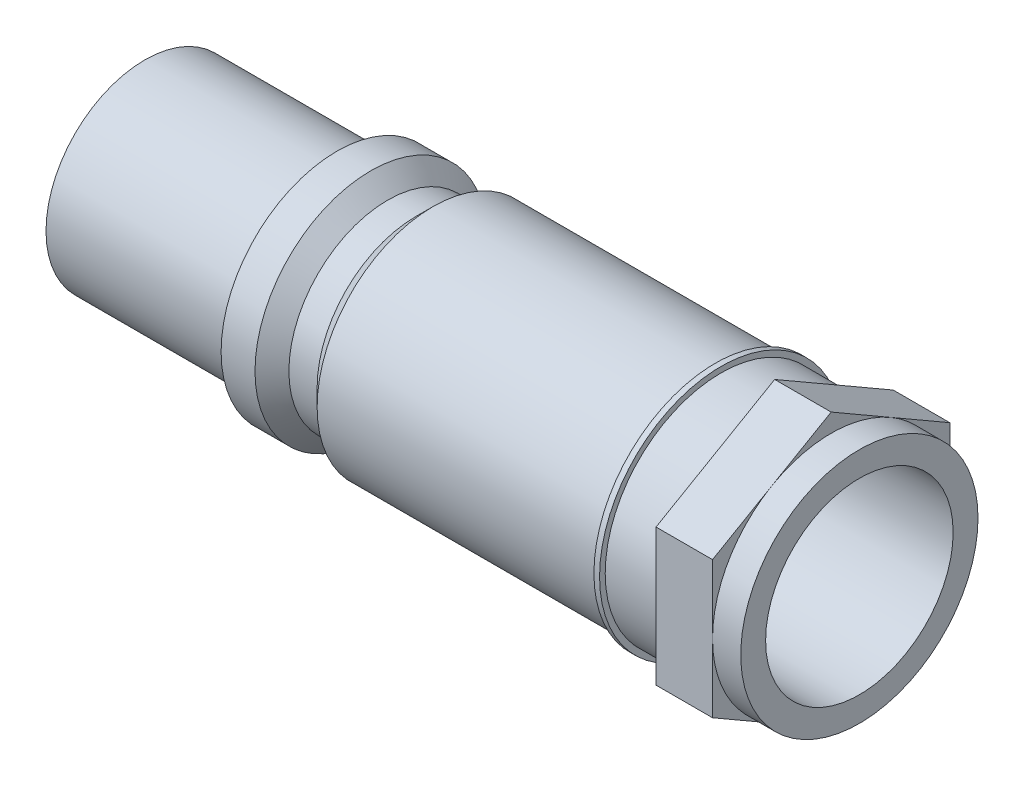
SolidWorks part; units mm, degrees
ref_plane "Alzado" through (0, 0, 0) normal (0, 0, 1) x (1, 0, 0)
ref_plane "Planta" through (0, 0, 0) normal (0, 1, 0) x (1, 0, 0)
ref_plane "Vista lateral" through (0, 0, 0) normal (1, 0, 0) x (0, 0, -1)
sketch "Croquis1" plane through (0, 0, 0) normal (0, 0, 1) x (1, 0, 0)
  line L0 (0, 0) -> (111.5, 0) construction
  line L1 (0, 0) -> (0, 17.5)
  line L2 (0, 17.5) -> (34, 17.5)
  line L3 (34, 17.5) -> (34, 20.5)
  line L4 (34, 20.5) -> (40, 20.5)
  line L5 (40, 20.5) -> (43, 17.5)
  line L6 (43, 17.5) -> (48, 17.5)
  line L7 (48, 17.5) -> (51, 20.5)
  line L11 (111.5, 20.5) -> (111.5, 0)
  line L12 (0, 0) -> (111.5, 0)
  line L13 (51, 20.5) -> (101, 20.5)
  line L14 (101, 20.5) -> (101, 21.5)
  line L15 (101, 21.5) -> (102, 21.5)
  line L16 (102, 21.5) -> (102, 20.5)
  line L17 (102, 20.5) -> (111.5, 20.5)
  dimension "D1" = 35
  dimension "D2" = 111.5
  dimension "D3" = 50
  dimension "D4" = 1
  dimension "D5" = 34
  dimension "D6" = 6
  dimension "D7" = 3
  dimension "D8" = 5
  dimension "D9" = 225
  dimension "D10" = 1
  dimension "D11" = 9.5
revolve "Revolución1" add sketch "Croquis1" angle 360 about L0
sketch "Croquis4" plane through (111.5, 0, 0) normal (1, 0, 0) x (0, 0, -1)
  line L1 (0, 24.2487) -> (-21, 12.1244)
  line L2 (-21, 12.1244) -> (-21, -12.1244)
  line L3 (-21, -12.1244) -> (0, -24.2487)
  line L4 (0, -24.2487) -> (21, -12.1244)
  line L5 (21, -12.1244) -> (21, 12.1244)
  line L6 (21, 12.1244) -> (0, 24.2487)
  circle A0 centre (0, 0) radius 21 construction
  dimension "D1" = 42
extrude "Saliente-Extruir2" add sketch "Croquis4" along normal blind 10
sketch "Croquis5" plane through (121.5, 0, 0) normal (1, 0, 0) x (0, 0, -1)
  circle A0 centre (0, 0) radius 21
  dimension "D1" = 42
extrude "Saliente-Extruir3" add sketch "Croquis5" along normal blind 5
sketch "Croquis6" plane through (126.5, 0, 0) normal (1, 0, 0) x (0, 0, -1)
  circle A0 centre (0, 0) radius 16.6
  dimension "D1" = 33.2
extrude "Cortar-Extruir2" cut sketch "Croquis6" against normal through all
